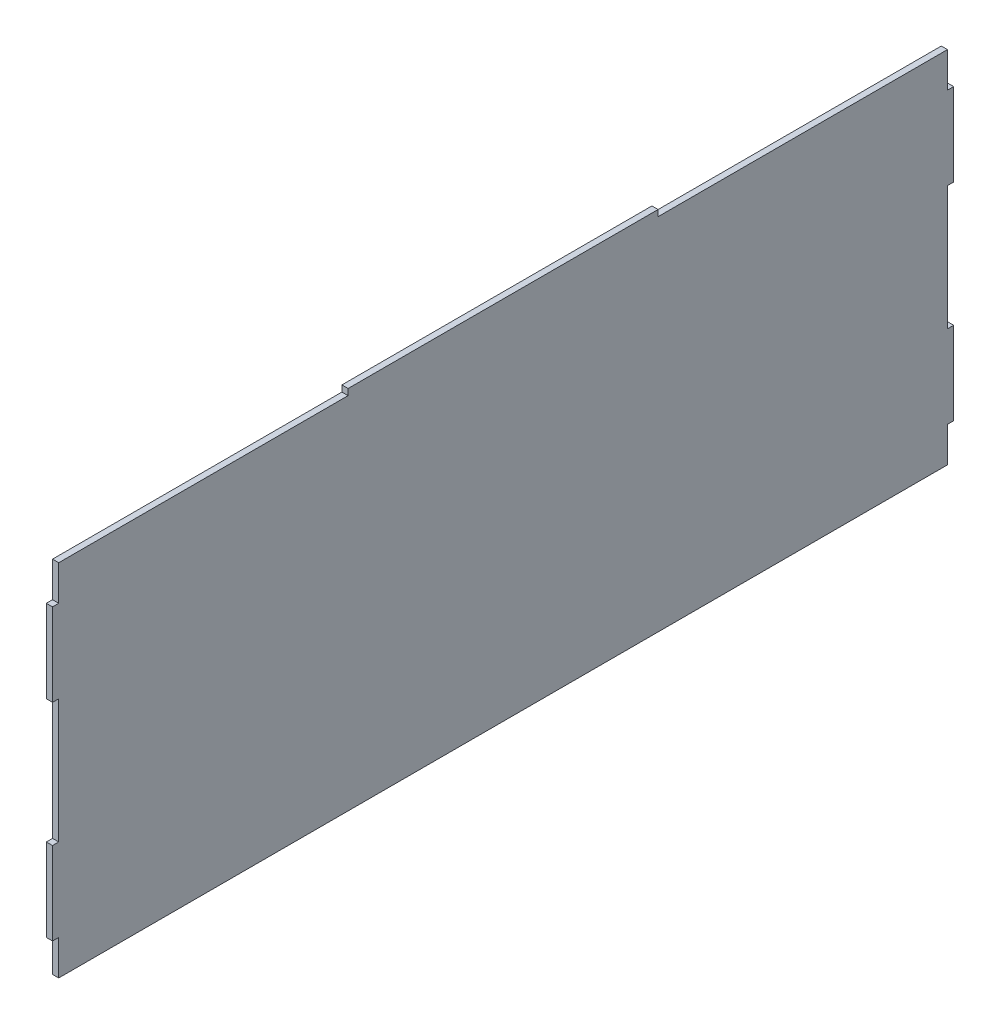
SolidWorks part; units mm, degrees
ref_plane "Front Plane" through (0, 0, 0) normal (0, 0, 1) x (1, 0, 0)
ref_plane "Top Plane" through (0, 0, 0) normal (0, 1, 0) x (1, 0, 0)
ref_plane "Right Plane" through (0, 0, 0) normal (1, 0, 0) x (0, 0, -1)
sketch "Sketch1" plane through (0, 0, 0) normal (0, 0, 1) x (1, 0, 0)
  line L1 (1311.4158, 414.511) -> (1317.4158, 414.511)
  line L2 (1311.4158, 414.511) -> (1311.4158, 66.511)
  line L3 (1311.4158, 66.511) -> (1317.4158, 66.511)
  line L4 (1317.4158, 414.511) -> (1317.4158, 66.511)
  line L7 (1311.4158, 380.511) -> (1317.4158, 380.511)
  line L8 (1311.4158, 380.511) -> (1311.4158, 300.511)
  line L9 (1311.4158, 300.511) -> (1317.4158, 300.511)
  line L10 (1317.4158, 380.511) -> (1317.4158, 300.511)
  line L11 (1311.4158, 180.511) -> (1317.4158, 180.511)
  line L12 (1311.4158, 180.511) -> (1311.4158, 100.511)
  line L13 (1311.4158, 100.511) -> (1317.4158, 100.511)
  line L14 (1317.4158, 180.511) -> (1317.4158, 100.511)
  dimension "D1" = 6
extrude "Boss-Extrude1" add sketch "Sketch1" along normal blind 860 contours L2 L7 L4 L1 | L2 L11 L4 L9 | L13 L2 L3 L4
sketch "Sketch2" plane through (1311.4158, 0, 0) normal (-1, 0, 0) x (0, 0, 1)
  line L0 (0, 300.511) -> (0, 180.511)
  line L1 (0, 380.511) -> (-6, 380.511)
  line L3 (0, 300.511) -> (-6, 300.511)
  line L4 (-6, 380.511) -> (-6, 300.511)
  line L5 (0, 180.511) -> (-6, 180.511)
  line L7 (0, 100.511) -> (-6, 100.511)
  line L8 (-6, 180.511) -> (-6, 100.511)
  line L9 (860, 380.511) -> (866, 380.511)
  line L11 (860, 300.511) -> (866, 300.511)
  line L12 (866, 380.511) -> (866, 300.511)
  line L13 (860, 180.511) -> (866, 180.511)
  line L15 (860, 100.511) -> (866, 100.511)
  line L16 (866, 180.511) -> (866, 100.511)
  line L17 (0, 414.511) -> (860, 414.511)
  line L18 (0, 414.511) -> (0, 380.511)
  line L19 (0, 66.511) -> (860, 66.511)
  line L20 (860, 414.511) -> (860, 380.511)
  line L21 (0, 100.511) -> (0, 66.511)
  line L22 (860, 100.511) -> (860, 66.511)
  line L23 (860, 300.511) -> (860, 180.511)
  dimension "D2" = 6
  dimension "D3" = 6
  dimension "D4" = 6
extrude "Boss-Extrude2" add sketch "Sketch2" against normal up to surface (6 mm away)
sketch "Sketch3" plane through (1311.4158, 0, 0) normal (-1, 0, 0) x (0, 0, 1)
  line L0 (860, 414.511) -> (0, 414.511) construction
  line L1 (280, 408.511) -> (580, 408.511)
  line L2 (280, 408.511) -> (280, 420.511)
  line L3 (280, 420.511) -> (580, 420.511)
  line L4 (580, 408.511) -> (580, 420.511)
  line L5 (280, 408.511) -> (580, 420.511) construction
  line L6 (280, 420.511) -> (580, 408.511) construction
  point P0 (430, 414.511)
  dimension "D1" = 12
  dimension "D2" = 300
extrude "Boss-Extrude3" add sketch "Sketch3" against normal up to surface (6 mm away)
